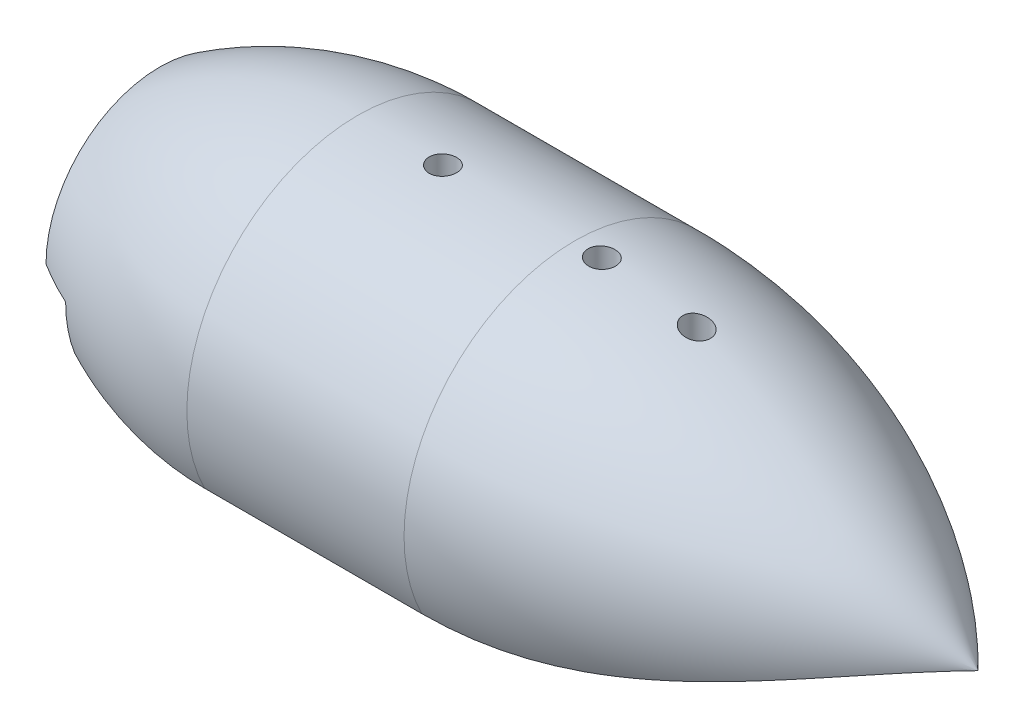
SolidWorks part; units mm, degrees
ref_plane "Front Plane" through (0, 0, 0) normal (0, 0, 1) x (1, 0, 0)
ref_plane "Top Plane" through (0, 0, 0) normal (0, 1, 0) x (1, 0, 0)
ref_plane "Right Plane" through (0, 0, 0) normal (1, 0, 0) x (0, 0, -1)
sketch "Sketch2" plane through (0, 0, 0) normal (1, 0, 0) x (0, 0, -1)
  circle A0 centre (0, 0) radius 18.288
  dimension "D1" = 36.576
extrude "Extrude1" add sketch "Sketch2" along normal blind 87.63
sketch "Sketch3" plane through (0, 0, 0) normal (0, 0, 1) x (1, 0, 0)
  line L0 (87.63, -18.288) -> (87.63, 18.288) construction
  line L2 (44.45, 0) -> (44.45, 18.288) construction
  line L3 (87.63, 18.288) -> (0, 18.288) construction
  line L4 (87.63, 0.0088) -> (87.63, 18.288)
  line L5 (87.63, 18.288) -> (44.45, 18.288)
  line L6 (0, 0) -> (21.1849, 0) construction
  line L7 (21.1849, 0) -> (21.1849, 18.288) construction
  line L8 (0, 0) -> (0, 12.192) construction
  line L9 (0, 18.288) -> (0, -18.288) construction
  line L10 (21.1849, 18.288) -> (0, 18.288)
  line L11 (0, 18.288) -> (0, 12.192)
  arc A0 (44.45, 18.288) -> (87.63, 0.0088) centre (44.45, -41.8525) cw
  arc A1 (21.1849, 18.288) -> (0, 12.192) centre (21.1849, -21.5709) ccw
  dimension "D1" = 12.192
revolve "shape" cut sketch "Sketch3" angle 360 about L6
sketch "Sketch5" plane through (0, 0, 0) normal (-1, 0, 0) x (0, 0, 1)
  circle A0 centre (0, 0) radius 7.9375
  dimension "D1" = 15.875
extrude "Cut-Extrude2" cut sketch "Sketch5" against normal blind 24.13
sketch "Sketch4" plane through (0, 0, 0) normal (-1, 0, 0) x (0, 0, 1)
  line L0 (0, -20.6375) -> (0, 0) construction
  line L1 (16.3949, -8.103) -> (-16.3949, -8.103)
  line L2 (0, -20.6375) -> (16.3949, -8.103) construction
  line L3 (16.3949, -8.103) -> (16.3949, -20.6375)
  line L4 (16.3949, -20.6375) -> (-16.3949, -20.6375)
  line L5 (-16.3949, -20.6375) -> (-16.3949, -8.103)
  circle A1 centre (0, 0) radius 18.288 construction
  dimension "D1" = 20.6375
  dimension "D2" = 20.6375
extrude "Cut-Extrude1" cut sketch "Sketch4" against normal through all
sketch "Sketch8" plane through (0, 0, 0) normal (0, 1, 0) x (1, 0, 0)
  line L0 (26.2128, 3.2946) -> (26.2128, 11.8036)
  line L1 (26.2128, 3.2946) -> (34.4678, 3.2946)
  line L2 (18.923, 11.8036) -> (26.2128, 11.8036)
  line L3 (26.2128, -3.3094) -> (34.4678, -3.3094)
  line L4 (18.923, 11.8036) -> (18.923, -11.8184)
  line L5 (18.923, -11.8184) -> (26.2128, -11.8184)
  line L6 (26.2128, -11.8184) -> (26.2128, -3.3094)
  line L7 (34.4678, 11.8036) -> (42.3418, 11.8036)
  line L8 (34.4678, -11.8184) -> (34.4678, -3.3094)
  line L9 (34.4678, -11.8184) -> (42.3418, -11.8184)
  line L10 (42.3418, 11.8036) -> (42.3418, -11.8184)
  line L11 (34.4678, 3.2946) -> (34.4678, 11.8036)
  line L12 (42.3418, -0.0074) -> (18.923, -0.0074) construction
  line L13 (0, 0) -> (92.1788, -0.0362) construction
  line L14 (0, 12.192) -> (0, -12.192) construction
  line L15 (26.2128, 3.2946) -> (26.2128, -3.3094) construction
  point P20 (26.2128, -0.0074)
  dimension "D1" = 7.2898
  dimension "D2" = 7.874
  dimension "D3" = 8.255
  dimension "D4" = 18.923
  dimension "D5" = 23.622
  dimension "D6" = 6.604
extrude "camera base and transmitter" cut sketch "Sketch8" along normal blind 12.954 and the other way through all
fillet "Fillet1" radius 1.5875 8 edges at (42.3418, 2.4255, -11.8036) (34.4678, 2.4255, -11.8036) (26.2128, 2.4255, -11.8036) (18.923, 2.4255, -11.8036) (42.3418, 2.4255, 11.8184) (34.4678, 2.4255, 11.8184) (26.2128, 2.4255, 11.8184) (18.923, 2.4255, 11.8184)
sketch "r" plane through (0, 0, 0) normal (0, 1, 0) x (1, 0, 0)
  line L1 (65.7098, -0.0074) -> (42.3418, -0.0074) construction
  line L2 (42.3418, 3.1676) -> (42.3418, -3.1824)
  line L3 (42.3418, -3.1824) -> (65.7098, -3.1824)
  line L4 (65.7098, 3.1676) -> (65.7098, -3.1824)
  line L5 (42.3418, 3.1676) -> (65.7098, 3.1676)
  line L6 (42.3418, -10.2309) -> (42.3418, 10.2161) construction
  line L7 (42.3418, -10.2309) -> (42.3418, 10.2161) construction
  dimension "D1" = 6.35
  dimension "D2" = 23.368
extrude "tab slot" cut sketch "r" along normal blind 10.16 and the other way through all
sketch "Sketch9" plane through (18.923, 0, 0) normal (1, 0, 0) x (0, 0, -1)
  line L1 (-7.874, 7.874) -> (7.874, 7.874)
  line L2 (-7.874, 7.874) -> (-7.874, -2.6762)
  line L3 (-7.874, -2.6762) -> (7.874, -2.6762)
  line L4 (7.874, 7.874) -> (7.874, -2.6762)
extrude "Cut-Extrude6" cut sketch "Sketch9" against normal blind 5.588
sketch "Sketch10" plane through (0, 0, 0) normal (0, 1, 0) x (1, 0, 0)
  line L0 (0, 12.192) -> (0, -12.192) construction
  line L1 (0, -12.7042) -> (10.9133, -12.7042)
  line L2 (0, -12.7042) -> (0, 12.8228)
  line L3 (0, 12.8228) -> (10.9133, 12.8228)
  line L4 (10.9133, -12.7042) -> (10.9133, -7.874)
  line L5 (15.1084, 0.0593) -> (0, 0.0593) construction
  line L6 (18.923, 10.2161) -> (18.923, -10.2309) construction
  line L7 (10.9133, -7.874) -> (18.923, -7.874)
  line L8 (18.923, -7.874) -> (18.923, 7.874)
  line L9 (18.923, 7.874) -> (10.9133, 7.874)
  line L11 (10.9133, 7.874) -> (10.9133, 12.8228)
  line L12 (10.9133, -7.874) -> (10.9133, 7.874) construction
  dimension "D1" = 25.527
extrude "holder interface" cut sketch "Sketch10" against normal through all
sketch "Sketch11" plane through (0, 0, 0) normal (0, 0, 1) x (1, 0, 0)
  line L0 (0, 12.192) -> (0, 0) construction
  line L1 (0, -7.3177) -> (4.572, -7.3177)
  line L2 (0, -7.3177) -> (0, 0)
  line L3 (0, 0) -> (4.572, 0)
  line L4 (4.572, -7.3177) -> (4.572, 0)
  line L5 (0.8391, 0) -> (10.9133, 0) construction
  point P6 (0.8391, 0)
  point P7 (5.491, -8.103)
  dimension "D1" = 4.572
extrude "Cut-Extrude8" cut sketch "Sketch11" against normal through all and the other way through all
fillet "Fillet2" radius 3.175 2 edges at (13.335, 4.438, 7.874) (13.335, 4.438, -7.874)
fillet "Fillet3" radius 3.175 2 edges at (65.7098, 1.0285, 3.1824) (65.7098, 1.0285, -3.1676)
sketch "Sketch13" plane through (0, 12.954, 0) normal (0, -1, 0) x (1, 0, 0)
  line L3 (26.2128, 3.3094) -> (26.2128, -3.2946) construction
  line L4 (34.4678, 3.3094) -> (34.4678, -3.2946) construction
  line L5 (34.4678, 0.0074) -> (26.2128, 0.0074) construction
sketch "Sketch14" plane through (0, 10.16, 0) normal (0, -1, 0) x (1, 0, 0)
  line L0 (65.7098, 0.0074) -> (34.4678, 0.0074) construction
  line L1 (34.4678, -10.2161) -> (34.4678, -3.2946) construction
  line L2 (34.4678, 3.3094) -> (34.4678, -3.2946) construction
hole_wizard "#4 Clearance Hole1" positions "3DSketch1" profile "Sketch12" hole size "#4" standard "Ansi Inch"
sketch3d "3DSketch1"
  line L1 (65.7098, 10.16, 0.0074) -> (34.4678, 10.16, 0.0074) construction
  line L2 (34.4678, 12.954, 0.0074) -> (26.2128, 12.954, 0.0074) construction
  point P0 (30.3403, 12.954, 0.0074)
  point P2 (47.3583, 10.16, 0.0074)
  point P4 (57.5183, 10.16, 0.0074)
  dimension "D1" = 10.16
  dimension "D2" = 12.8905
sketch "Sketch12" plane through (30.3403, 12.954, 0.0074) normal (1, 0, 0) x (0, 0, -1)
  line L0 (0, 0) -> (0, 5.334)
  line L1 (0, 5.334) -> (1.4732, 5.334)
  line L2 (1.4732, 5.334) -> (1.4732, 0)
  line L5 (1.4732, 0) -> (0, 0)
  line L11 (0, -6.35) -> (0, 107.95) construction
  dimension "Thru Hole Dia." = 2.9464
  dimension "Thru Hole Depth" = 5.334
fillet "Fillet4" radius 2.54 2 edges at (10.9133, -4.0515, -12.8228) (10.9133, -4.0515, 12.7042)
sketch "Sketch15" plane through (0, -8.103, 0) normal (0, -1, 0) x (1, 0, 0)
  circle A0 centre (38.792, 0.0074) radius 4.7625
  dimension "D1" = 9.525
extrude "Cut-Extrude9" cut sketch "Sketch15" against normal offset from surface (22.835 mm away) 1.778
sketch "Sketch16" plane through (0, 0, 0) normal (-1, 0, 0) x (0, 0, 1)
  circle A0 centre (0, -20.6375) radius 20.6375
  dimension "D1" = 41.275
extrude "Cut-Extrude10" cut sketch "Sketch16" against normal through all
